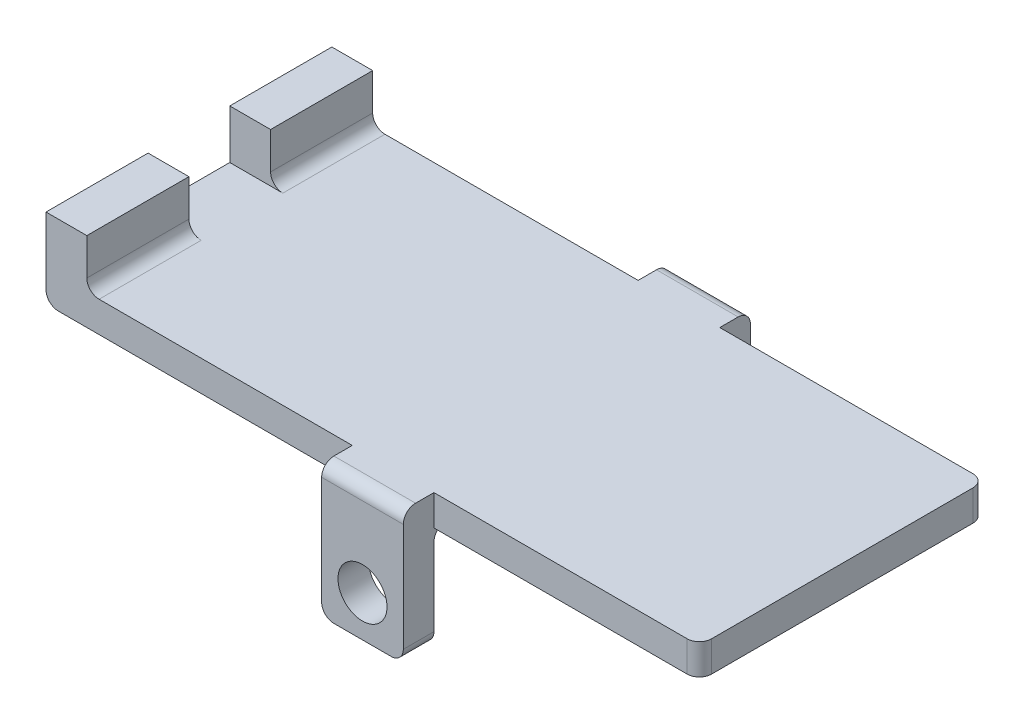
SolidWorks part; units mm, degrees
ref_plane "Front Plane" through (0, 0, 0) normal (0, 0, 1) x (1, 0, 0)
ref_plane "Top Plane" through (0, 0, 0) normal (0, 1, 0) x (1, 0, 0)
ref_plane "Right Plane" through (0, 0, 0) normal (1, 0, 0) x (0, 0, -1)
sketch "Sketch1" plane through (0, 0, 0) normal (0, 0, 1) x (1, 0, 0)
  line L0 (-160, 12) -> (-160, -7.5)
  line L1 (-160, -7.5) -> (0, -7.5)
  line L2 (0, -7.5) -> (0, 0)
  line L3 (0, 0) -> (-150, 0)
  line L4 (-150, 0) -> (-150, 12)
  line L5 (-150, 12) -> (-160, 12)
  dimension "D1" = 10
  dimension "D2" = 12
  dimension "D3" = 7.5
  dimension "D4" = 150
extrude "Boss-Extrude1" add sketch "Sketch1" along normal blind 70
fillet "Fillet1" radius 3 3 edges at (-160, -7.5, 35) (0, -3.75, 0) (0, -3.75, 70)
sketch "Sketch2" plane through (0, 0, 70) normal (0, 0, 1) x (1, 0, 0)
  line L0 (-3, 0) -> (-150, 0) construction
  line L1 (-85, 0) -> (-65, 0)
  line L2 (-85, 0) -> (-85, -7.5)
  line L3 (-85, -7.5) -> (-65, -7.5)
  line L4 (-65, 0) -> (-65, -7.5)
  line L5 (-157, -7.5) -> (-3, -7.5) construction
  line L6 (-160, 12) -> (-160, -4.5) construction
  dimension "D1" = 20
  dimension "D2" = 75
extrude "Boss-Extrude2" add sketch "Sketch2" along normal blind 7.5
ref_plane "Plane1" through (0, 0, 35) normal (0, 0, 1) x (1, 0, 0)
mirror "Mirror1" about plane through (0, 0, 35) normal (0, 0, 1) of "Boss-Extrude2"
sketch "Sketch3" plane through (0, -7.5, 0) normal (0, -1, 0) x (1, 0, 0)
  line L5 (-85, 77.5) -> (-65, 77.5)
  line L6 (-85, 77.5) -> (-85, 70)
  line L7 (-85, 70) -> (-65, 70)
  line L8 (-65, 77.5) -> (-65, 70)
extrude "Boss-Extrude4" add sketch "Sketch3" along normal blind 25
mirror "Mirror2" about plane through (0, 0, 35) normal (0, 0, 1) of "Boss-Extrude4"
fillet "Fillet2" radius 3 8 edges at (-85, -32.5, -3.75) (-65, -32.5, -3.75) (-85, -32.5, 73.75) (-65, -32.5, 73.75) (-75, -7.5, 0) (-75, -7.5, 70) (-75, 0, -7.5) (-75, 0, 77.5)
sketch "Sketch4" plane through (0, 0, 77.5) normal (0, 0, 1) x (1, 0, 0)
  line L0 (-68, -32.5) -> (-82, -32.5) construction
  line L1 (-65, -29.5) -> (-65, -3) construction
  circle A0 centre (-75, -22.5) radius 6
  dimension "D1" = 12
  dimension "D2" = 10
  dimension "D3" = 10
extrude "Cut-Extrude1" cut sketch "Sketch4" against normal through all
sketch "Sketch5" plane through (-160, 0, 0) normal (-1, 0, 0) x (0, 0, 1)
  line L0 (70, 12) -> (0, 12) construction
  line L1 (25, 12) -> (45, 12)
  line L2 (25, 12) -> (25, 0)
  line L3 (25, 0) -> (45, 0)
  line L4 (45, 12) -> (45, 0)
  line L6 (70, 12) -> (70, -4.5) construction
  dimension "D1" = 12
  dimension "D2" = 20
  dimension "D3" = 25
extrude "Cut-Extrude2" cut sketch "Sketch5" against normal blind 10
fillet "Fillet3" radius 3 2 edges at (-150, 0, 12.5) (-150, 0, 57.5)
